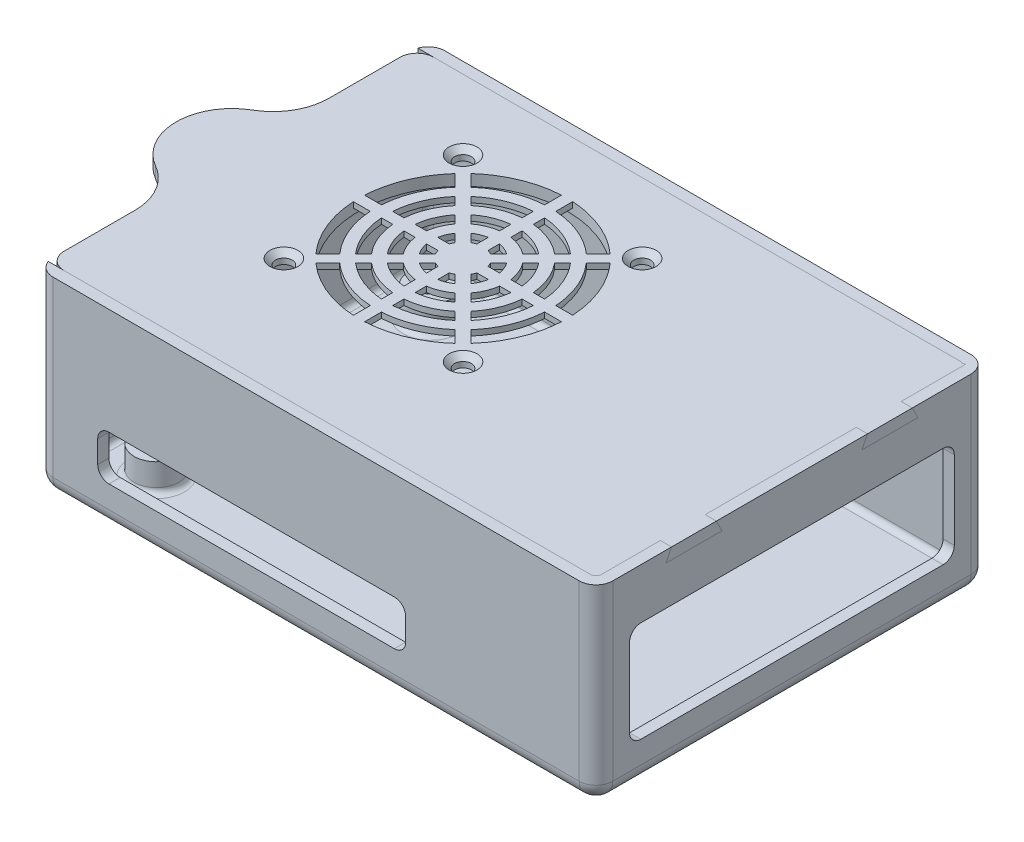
SolidWorks part; units mm, degrees
ref_plane "Front Plane" through (0, 0, 0) normal (0, 0, 1) x (1, 0, 0)
ref_plane "Top Plane" through (0, 0, 0) normal (0, 1, 0) x (1, 0, 0)
ref_plane "Right Plane" through (0, 0, 0) normal (1, 0, 0) x (0, 0, -1)
sketch "Sketch1" plane through (0, 0, 0) normal (0, 1, 0) x (1, 0, 0)
  line L1 (50, -35) -> (-50, -35)
  line L2 (50, -35) -> (50, 35)
  line L3 (50, 35) -> (-50, 35)
  line L4 (-50, -35) -> (-50, 35)
  line L5 (50, -35) -> (-50, 35) construction
  line L6 (50, 35) -> (-50, -35) construction
  point P0 (0, 0)
  dimension "D1" = 100
  dimension "D2" = 70
extrude "Boss-Extrude1" add sketch "Sketch1" along normal blind 34
shell "Shell1" thickness 2
sketch "Sketch2" plane through (0, 2, 0) normal (0, 1, 0) x (1, 0, 0)
  line L0 (-39, -24.5) -> (-39, 24.5) construction
  line L1 (42.5, -28) -> (-42.5, -28) construction
  line L2 (42.5, -28) -> (42.5, 28) construction
  line L3 (42.5, 28) -> (-42.5, 28) construction
  line L4 (-42.5, -28) -> (-42.5, 28) construction
  line L5 (42.5, -28) -> (-42.5, 28) construction
  line L6 (42.5, 28) -> (-42.5, -28) construction
  line L7 (-39, 24.5) -> (19, 24.5) construction
  line L8 (19, 24.5) -> (19, -24.5) construction
  circle A0 centre (-39, -24.5) radius 1.375 construction
  circle A1 centre (-39, -24.5) radius 2
  circle A2 centre (-39, -24.5) radius 4
  circle A3 centre (-39, 24.5) radius 2
  circle A4 centre (-39, 24.5) radius 4
  circle A5 centre (19, 24.5) radius 2
  circle A6 centre (19, 24.5) radius 4
  circle A7 centre (19, -24.5) radius 2
  circle A8 centre (19, -24.5) radius 4
  point P0 (0, 0)
  point P6 (-39, -24.5)
  dimension "D5" = 2.75
  dimension "D6" = 4
  dimension "D7" = 2
  dimension "D9" = 4
  dimension "D10" = 2
  dimension "D12" = 4
  dimension "D13" = 2
  dimension "D14" = 4
  dimension "D15" = 2
  dimension "D1" = 85
  dimension "D2" = 56
  dimension "D3" = 3.5
  dimension "D4" = 3.5
  dimension "D8" = 49
  dimension "D11" = 58
extrude "Boss-Extrude2" add sketch "Sketch2" along normal blind 5
sketch "Sketch3" plane through (-50, 0, 0) normal (-1, 0, 0) x (0, 0, 1)
  line L0 (-35, 34) -> (35, 34) construction
  line L1 (-33, 34) -> (33, 34)
  line L2 (-33, 34) -> (-33, 32)
  line L3 (-33, 32) -> (33, 32)
  line L4 (33, 34) -> (33, 32)
  line L5 (-35, 34) -> (-35, 0) construction
  line L6 (35, 34) -> (35, 0) construction
  dimension "D1" = 2
  dimension "D2" = 2
  dimension "D3" = 2
extrude "Cut-Extrude1" cut sketch "Sketch3" against normal up to surface (98 mm away)
sketch "Sketch4" plane through (0, 32, 0) normal (0, 1, 0) x (1, 0, 0)
  line L1 (-50, 33) -> (48, 33)
  line L2 (-50, 33) -> (-50, -33)
  line L3 (-50, -33) -> (48, -33)
  line L4 (48, 33) -> (48, -33)
extrude "Boss-Extrude3" add sketch "Sketch4" along normal blind 2 separate body
sketch "Sketch5" plane through (50, 0, 0) normal (1, 0, 0) x (0, 0, -1)
  line L0 (-35, 34) -> (0, 34) construction
  line L1 (-35, 34) -> (35, 34) construction
  line L2 (0, 34) -> (35, 34) construction
  line L3 (-17.5, 34) -> (-17.5, 32) construction
  line L4 (-12.5, 32) -> (-22.5, 32)
  line L5 (-21.5, 34) -> (-13.5, 34)
  line L6 (-21.5, 34) -> (-22.5, 32)
  line L7 (-13.5, 34) -> (-12.5, 32)
  line L8 (17.5, 34) -> (17.5, 32) construction
  line L9 (12.5, 32) -> (22.5, 32)
  line L10 (13.5, 34) -> (21.5, 34)
  line L11 (21.5, 34) -> (22.5, 32)
  line L12 (13.5, 34) -> (12.5, 32)
  point P12 (-17.5, 32)
  point P15 (-17.5, 34)
  point P20 (17.5, 32)
  point P23 (17.5, 34)
  dimension "D1" = 2
  dimension "D2" = 10
  dimension "D3" = 8
  dimension "D4" = 2
  dimension "D5" = 10
  dimension "D6" = 8
extrude "Cut-Extrude2" cut sketch "Sketch5" against normal blind 2
sketch "Sketch6" plane through (48, 0, 0) normal (1, 0, 0) x (0, 0, -1)
  line L0 (12.5, 32) -> (22.5, 32) construction
  line L1 (22.5, 32) -> (21.5, 34) construction
  line L2 (13.5, 34) -> (12.5, 32) construction
  line L3 (-22.5, 32) -> (-12.5, 32) construction
  line L4 (-21.5, 34) -> (-22.5, 32) construction
  line L5 (-33, 34) -> (33, 34) construction
  line L6 (-12.5, 32) -> (-13.5, 34) construction
  line L7 (12.5, 32) -> (22.5, 32)
  line L8 (22.5, 32) -> (21.5, 34)
  line L9 (13.5, 34) -> (12.5, 32)
  line L10 (-22.5, 32) -> (-12.5, 32)
  line L11 (-21.5, 34) -> (-22.5, 32)
  line L12 (-21.5, 34) -> (-13.5, 34)
  line L13 (-12.5, 32) -> (-13.5, 34)
  line L14 (13.5, 34) -> (21.5, 34)
extrude "Boss-Extrude4" add sketch "Sketch6" along normal blind 2
sketch "Sketch7" plane through (0, 34, 0) normal (0, 1, 0) x (1, 0, 0)
  line L0 (-13.25, 23.1066) -> (-13.25, -14.1066)
  line L1 (42.5, -28) -> (-42.5, -28) construction
  line L2 (42.5, -28) -> (42.5, 28) construction
  line L3 (42.5, 28) -> (-42.5, 28) construction
  line L4 (-42.5, -28) -> (-42.5, 28) construction
  line L5 (42.5, -28) -> (-42.5, 28) construction
  line L6 (42.5, 28) -> (-42.5, -28) construction
  line L7 (-5.75, -3) -> (-20.75, -3) construction
  line L8 (-5.75, -3) -> (-5.75, 12) construction
  line L9 (-5.75, 12) -> (-20.75, 12) construction
  line L10 (-20.75, -3) -> (-20.75, 12) construction
  line L11 (-5.75, -3) -> (-20.75, 12) construction
  line L12 (-5.75, 12) -> (-20.75, -3) construction
  line L13 (5.3566, 4.5) -> (-31.8566, 4.5)
  line L14 (-13.25, 4.5) -> (-0.0931, 17.6569)
  line L15 (-13.25, 4.5) -> (-26.4069, 17.6569)
  line L16 (-13.25, 4.5) -> (-26.4069, -8.6569)
  line L17 (-13.25, 4.5) -> (-0.0931, -8.6569)
  circle A0 centre (-13.25, 4.5) radius 10.6066
  circle A1 centre (-13.25, 4.5) radius 14.6066
  circle A2 centre (-13.25, 4.5) radius 18.6066
  circle A3 centre (-13.25, 4.5) radius 6.6066
  circle A4 centre (-13.25, 4.5) radius 2.6066
  point P0 (0, 0)
  point P6 (-13.25, 4.5)
  dimension "D6" = 4
  dimension "D7" = 4
  dimension "D8" = 4
  dimension "D9" = 4
  dimension "D1" = 85
  dimension "D2" = 56
  dimension "D3" = 15
  dimension "D4" = 16
  dimension "D5" = 21.75
other "Vent1" parameters "RibsDepth"=1, "RibsWidth"=2, "RibsOffset"=0, "SparsDepth"=1, "SparsWidth"=2, "SparsOffset"=0, "D7"=1, "D8"=0, "Draft"=1
fillet "Fillet1" radius 1 12 edges at (0, 2, 33) (0, 2, -33) (48, 2, 0) (-48, 2, 0) (-39, 2, 28.5) (-39, 2, -20.5) (19, 2, -20.5) (19, 2, 28.5) (-48, 17, 33) (48, 18, 33) (48, 18, -33) (-48, 17, -33)
fillet "Fillet2" radius 3 8 edges at (0, 0, 35) (50, 0, 0) (0, 0, -35) (-50, 0, 0) (50, 17, 35) (50, 17, -35) (-50, 17, -35) (-50, 17, 35)
sketch "Sketch8" plane through (0, 34, 0) normal (0, 1, 0) x (1, 0, 0)
  line L1 (-29.2504, -11.499) -> (2.7496, -11.499) construction
  line L2 (-29.2504, -11.499) -> (-29.2504, 20.501) construction
  line L3 (-29.2504, 20.501) -> (2.7496, 20.501) construction
  line L4 (2.7496, -11.499) -> (2.7496, 20.501) construction
  line L5 (-29.2504, -11.499) -> (2.7496, 20.501) construction
  line L6 (-29.2504, 20.501) -> (2.7496, -11.499) construction
  circle A0 centre (-13.2504, 4.501) radius 18.6063 construction
  circle A1 centre (-29.2504, 20.501) radius 1.5
  circle A2 centre (2.7496, 20.501) radius 1.5
  circle A3 centre (2.7496, -11.499) radius 1.5
  circle A4 centre (-29.2504, -11.499) radius 1.5
  spline S0 degree 3 poles (5.1167, 8.1534) (5.4765, 4.5) (5.1167, 0.8466) (4.0511, -2.6663) (2.3206, -5.9039) (-0.0083, -8.7417) (-2.8461, -11.0706) (-6.0837, -12.8011) (-9.5966, -13.8667) (-13.25, -14.2265) (-16.9034, -13.8667) (-20.4163, -12.8011) (-23.6539, -11.0706) (-26.4917, -8.7417) (-28.8206, -5.9039) (-30.5511, -2.6663) (-31.6167, 0.8466) (-31.9765, 4.5) (-31.6167, 8.1534) (-30.5511, 11.6663) (-28.8206, 14.9039) (-26.4917, 17.7417) (-23.6539, 20.0706) (-20.4163, 21.8011) (-16.9034, 22.8667) (-13.25, 23.2265) (-9.5966, 22.8667) (-6.0837, 21.8011) (-2.8461, 20.0706) (-0.0083, 17.7417) (2.3206, 14.9039) (4.0511, 11.6663) (5.1167, 8.1534) (5.4765, 4.5) (5.1167, 0.8466) knots -0.09375 -0.0625 -0.03125 0 0.03125 0.0625 0.09375 0.125 0.15625 0.1875 0.21875 0.25 0.28125 0.3125 0.34375 0.375 0.40625 0.4375 0.46875 0.5 0.53125 0.5625 0.59375 0.625 0.65625 0.6875 0.71875 0.75 0.78125 0.8125 0.84375 0.875 0.90625 0.9375 0.96875 1 1.03125 1.0625 1.09375 only from (0.595, 16.9308) to (5.3298, 5.5) construction
  spline S1 degree 3 poles (0.595, 16.9308) (1.1857, 16.2727) (2.4786, 14.6084) (4.0512, 11.6664) (5.0195, 8.4741) (5.2822, 6.383) (5.3298, 5.5) knots 0.008558 0.008558 0.008558 0.008558 0.03125 0.0625 0.09375 0.116442 0.116442 0.116442 0.116442
  spline S2 degree 3 poles (5.1167, 8.1534) (5.4765, 4.5) (5.1167, 0.8466) (4.0511, -2.6663) (2.3206, -5.9039) (-0.0083, -8.7417) (-2.8461, -11.0706) (-6.0837, -12.8011) (-9.5966, -13.8667) (-13.25, -14.2265) (-16.9034, -13.8667) (-20.4163, -12.8011) (-23.6539, -11.0706) (-26.4917, -8.7417) (-28.8206, -5.9039) (-30.5511, -2.6663) (-31.6167, 0.8466) (-31.9765, 4.5) (-31.6167, 8.1534) (-30.5511, 11.6663) (-28.8206, 14.9039) (-26.4917, 17.7417) (-23.6539, 20.0706) (-20.4163, 21.8011) (-16.9034, 22.8667) (-13.25, 23.2265) (-9.5966, 22.8667) (-6.0837, 21.8011) (-2.8461, 20.0706) (-0.0083, 17.7417) (2.3206, 14.9039) (4.0511, 11.6663) (5.1167, 8.1534) (5.4765, 4.5) (5.1167, 0.8466) knots -0.09375 -0.0625 -0.03125 0 0.03125 0.0625 0.09375 0.125 0.15625 0.1875 0.21875 0.25 0.28125 0.3125 0.34375 0.375 0.40625 0.4375 0.46875 0.5 0.53125 0.5625 0.59375 0.625 0.65625 0.6875 0.71875 0.75 0.78125 0.8125 0.84375 0.875 0.90625 0.9375 0.96875 1 1.03125 1.0625 1.09375 only from (-27.095, -7.9308) to (-31.8298, 3.5) construction
  spline S3 degree 3 poles (-27.095, -7.9308) (-27.6857, -7.2727) (-28.9786, -5.6084) (-30.5512, -2.6664) (-31.5195, 0.5259) (-31.7822, 2.617) (-31.8298, 3.5) knots 0.508558 0.508558 0.508558 0.508558 0.53125 0.5625 0.59375 0.616442 0.616442 0.616442 0.616442
  dimension "D2" = 3
  dimension "D3" = 3
  dimension "D4" = 3
  dimension "D5" = 3
  dimension "D1" = 32
extrude "Cut-Extrude3" cut sketch "Sketch8" against normal blind 2 contours A4 | A1 | A2 | A3
chamfer "Chamfer1" distance 1 angle 45 4 edges at (-29.2504, 34, 12.999) (2.7496, 34, 12.999) (2.7496, 34, -19.001) (-29.2504, 34, -19.001)
fillet "Fillet3" radius 3 2 edges at (-50, 33, -33) (-50, 33, 33)
sketch "Sketch9" plane through (0, 34, 0) normal (0, 1, 0) x (1, 0, 0)
  line L0 (-50, 30) -> (-50, -30) construction
  line L1 (-50, 10) -> (-50, -10)
  arc A0 (-50, 10) -> (-50, -10) centre (-50, 0) ccw
  dimension "D1" = 10
extrude "Boss-Extrude5" add sketch "Sketch9" against normal blind 2
sketch "Sketch10" plane through (50, 0, 0) normal (1, 0, 0) x (0, 0, -1)
  line L0 (33, 7) -> (29, 7) construction
  line L1 (33, 3) -> (33, 34) construction
  line L3 (28.5, 7) -> (20.5, 7) construction
  line L4 (-33, 7) -> (-29, 7) construction
  line L5 (-33, 34) -> (-33, 3) construction
  line L7 (-27, 7) -> (27, 7)
  line L8 (-29, 9) -> (-29, 23)
  line L9 (-27, 25) -> (27, 25)
  line L10 (29, 9) -> (29, 23)
  arc A0 (29, 9) -> (27, 7) centre (27, 9) cw
  arc A1 (27, 25) -> (29, 23) centre (27, 23) cw
  arc A2 (-29, 9) -> (-27, 7) centre (-27, 9) ccw
  arc A3 (-29, 23) -> (-27, 25) centre (-27, 23) cw
  point P17 (29, 25)
  dimension "D4" = 2
  dimension "D1" = 4
  dimension "D2" = 4
  dimension "D3" = 18
extrude "Cut-Extrude4" cut sketch "Sketch10" against normal blind 2
sketch "Sketch11" plane through (0, 0, 35) normal (0, 0, 1) x (1, 0, 0)
  line L0 (-35, 7) -> (-43, 7) construction
  line L1 (-35, 7) -> (-43, 7) construction
  line L3 (-37, 7) -> (14, 7)
  line L4 (-39, 9) -> (-39, 13)
  line L5 (-37, 15) -> (14, 15)
  line L6 (16, 9) -> (16, 13)
  arc A0 (14, 7) -> (16, 9) centre (14, 9) ccw
  arc A1 (14, 15) -> (16, 13) centre (14, 13) cw
  arc A2 (-37, 7) -> (-39, 9) centre (-37, 9) cw
  arc A3 (-39, 13) -> (-37, 15) centre (-37, 13) cw
  point P8 (16, 7)
  point P11 (16, 15)
  point P14 (-39, 7)
  point P17 (-39, 15)
  dimension "D3" = 2
  dimension "D1" = 8
  dimension "D2" = 55
extrude "Cut-Extrude5" cut sketch "Sketch11" against normal blind 2
fillet "Fillet4" radius 10 2 edges at (-50, 33, -10) (-50, 33, 10)
other "Save Bodies1"
